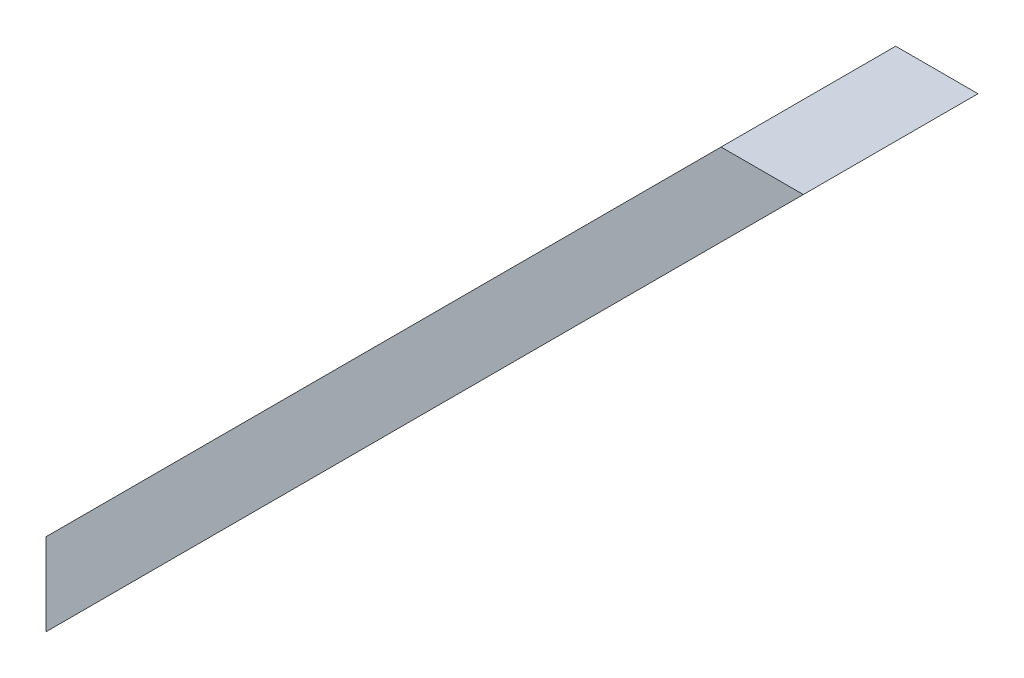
SolidWorks part; units mm, degrees
ref_plane "Front" through (0, 0, 0) normal (0, 0, 1) x (1, 0, 0)
ref_plane "Top" through (0, 0, 0) normal (0, 1, 0) x (1, 0, 0)
ref_plane "Right" through (0, 0, 0) normal (1, 0, 0) x (0, 0, -1)
sketch "Sketch1" plane through (0, 0, 0) normal (0, 0, 1) x (1, 0, 0)
  line L0 (-29.0998, 0) -> (115.5381, 0) construction
  line L1 (0, 35.1095) -> (0, -110.0467) construction
  line L2 (-17.8253, -133.7908) -> (130.6062, 14.6407) construction
  line L3 (-20.2457, -150.3534) -> (145.2469, 15.1393) construction
  line L4 (0, -130.1076) -> (130.1076, 0)
  line L5 (130.1076, 0) -> (115.9655, 0)
  line L6 (115.9655, 0) -> (0, -115.9655)
  line L7 (0, -115.9655) -> (0, -130.1076)
  dimension "D1" = 45
  dimension "D2" = 10
  dimension "D3" = 184
extrude "Extrude1" add sketch "Sketch1" along normal blind 30
